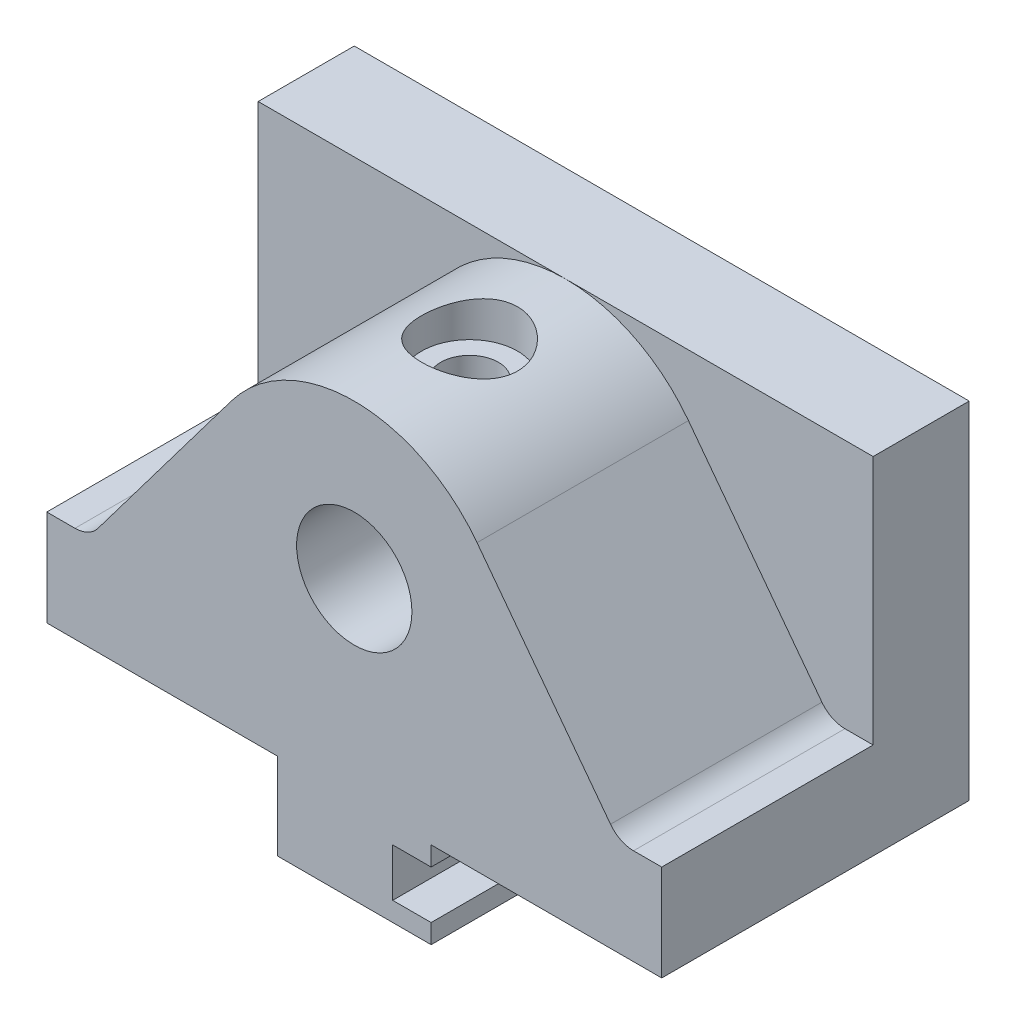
SolidWorks part; units mm, degrees
ref_plane "Front Plane" through (0, 0, 0) normal (0, 0, 1) x (1, 0, 0)
ref_plane "Top Plane" through (0, 0, 0) normal (0, 1, 0) x (1, 0, 0)
ref_plane "Right Plane" through (0, 0, 0) normal (1, 0, 0) x (0, 0, -1)
sketch "Sketch1" plane through (0, 0, 0) normal (0, 0, 1) x (1, 0, 0)
  line L0 (0, 0) -> (0, 40.9271) construction
  line L1 (-32, 0) -> (-8, 0)
  line L2 (-8, 0) -> (-8, -9)
  line L3 (-8, -9) -> (8, -9)
  line L4 (8, -9) -> (8, 0)
  line L5 (8, 0) -> (32, 0)
  line L6 (32, 0) -> (32, 10)
  line L7 (32, 10) -> (27.5697, 10)
  line L8 (27.5697, 10) -> (12.7782, 29.629)
  line L9 (-12.7782, 29.629) -> (-27.5697, 10)
  line L10 (-27.5697, 10) -> (-32, 10)
  line L11 (-32, 10) -> (-32, 0)
  arc A0 (12.7782, 29.629) -> (-12.7782, 29.629) centre (0, 20) ccw
  dimension "D7" = 16
  dimension "D1" = 16
  dimension "D2" = 64
  dimension "D3" = 10
  dimension "D4" = 9
  dimension "D5" = 36
  dimension "D6" = 74
extrude "Boss-Extrude1" add sketch "Sketch1" along normal blind 22
sketch "Sketch2" plane through (0, 0, 0) normal (0, 0, -1) x (-1, 0, 0)
  line L0 (-32, 0) -> (-32, 10) construction
  line L1 (-8, 0) -> (-32, 0) construction
  line L2 (-8, -9) -> (-8, 0) construction
  line L3 (8, -9) -> (-8, -9) construction
  line L4 (8, 0) -> (8, -9) construction
  line L5 (32, 0) -> (8, 0) construction
  line L6 (32, 10) -> (32, 0) construction
  line L7 (-32, 0) -> (-32, 10)
  line L8 (-8, 0) -> (-32, 0)
  line L9 (-8, -9) -> (-8, 0)
  line L10 (8, -9) -> (-8, -9)
  line L11 (8, 0) -> (8, -9)
  line L12 (32, 0) -> (8, 0)
  line L13 (32, 10) -> (32, 0)
  line L14 (-32, 36) -> (32, 36)
  line L15 (-32, 36) -> (-32, 10)
  line L17 (32, 36) -> (32, 10)
  arc A0 (12.7782, 29.629) -> (-12.7782, 29.629) centre (0, 20) ccw construction
extrude "Boss-Extrude2" add sketch "Sketch2" along normal blind 10
fillet "Fillet1" radius 3 2 edges at (-27.5697, 10, 11) (27.5697, 10, 11)
sketch "Sketch3" plane through (0, 0, 22) normal (0, 0, 1) x (1, 0, 0)
  circle A0 centre (0, 20) radius 6
  arc A1 (12.7782, 29.629) -> (-12.7782, 29.629) centre (0, 20) ccw construction
  dimension "D1" = 12
extrude "Cut-Extrude1" cut sketch "Sketch3" against normal blind 24
hole_wizard "Ø6.0 (6) Diameter Hole1" positions "Sketch5" profile "Sketch4" hole size "Ø6.0" standard "Ansi Metric"
sketch "Sketch5" plane through (0, -9, 0) normal (0, -1, 0) x (1, 0, 0)
  line L0 (-8, 22) -> (8, 22) construction
  point P0 (0, 14)
  point P1 (0, -2)
  dimension "D1" = 8
  dimension "D2" = 16
sketch "Sketch4" plane through (0, -9, 14) normal (1, 0, 0) x (0, 0, -1)
  line L0 (0, 0) -> (0, 17.8026)
  line L1 (0, 17.8026) -> (3, 16)
  line L2 (3, 16) -> (3, 0)
  line L5 (3, 0) -> (0, 0)
  line L10 (0, 17.8026) -> (-3, 16) construction
  line L11 (0, -6.35) -> (0, 107.95) construction
  dimension "Hole Dia." = 6
  dimension "Hole Depth" = 16
  dimension "Drill Angle" = 118
hole_wizard "CBORE for M6 SBHCS1" positions "Sketch12" profile "Sketch11" counterbore size "M6" standard "Ansi Metric"
sketch "Sketch12" plane through (0, 36, 0) normal (0, 1, 0) x (-1, 0, 0)
  line L0 (32, -10) -> (-32, -10) construction
  point P0 (0, 10)
  dimension "D1" = 20
sketch "Sketch11" plane through (0, 36, 10) normal (1, 0, 0) x (0, 0, 1)
  line L0 (0, 0) -> (0, 10)
  line L1 (0, 10) -> (3, 10)
  line L3 (3, 10) -> (3, 4)
  line L4 (3, 4) -> (5, 4)
  line L5 (5, 4) -> (5, 0)
  line L7 (5, 0) -> (0, 0)
  line L11 (0, -6.35) -> (0, 107.95) construction
  dimension "Thru Hole Dia." = 6
  dimension "Thru Hole Depth" = 10
  dimension "C'Bore Dia." = 10
  dimension "C'Bore Depth" = 4
sketch "Sketch16" plane through (0, 0, 22) normal (0, 0, 1) x (1, 0, 0)
  line L0 (8, -9) -> (8, 0) construction
  line L1 (8, -2) -> (4, -2)
  line L2 (8, -2) -> (8, -7)
  line L3 (8, -7) -> (4, -7)
  line L4 (4, -2) -> (4, -7)
  line L5 (-8, -9) -> (8, -9) construction
  dimension "D1" = 4
  dimension "D2" = 5
  dimension "D3" = 2
extrude "Cut-Extrude2" cut sketch "Sketch16" against normal through all
